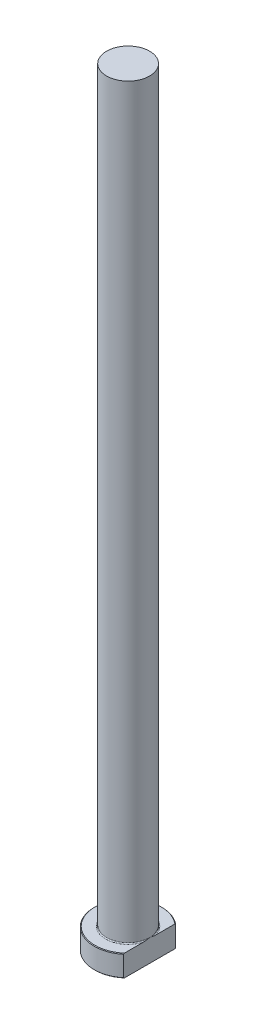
SolidWorks part; units mm, degrees
ref_plane "Front Plane" through (0, 0, 0) normal (0, 0, 1) x (1, 0, 0)
ref_plane "Top Plane" through (0, 0, 0) normal (0, 1, 0) x (1, 0, 0)
ref_plane "Right Plane" through (0, 0, 0) normal (1, 0, 0) x (0, 0, -1)
sketch "Sketch1" plane through (0, 0, 0) normal (0, 0, 1) x (1, 0, 0)
  line L0 (0, 259.9588) -> (0, -15.1925) construction
  line L1 (0, 0) -> (-11, 0)
  line L2 (-11, 0) -> (-11, 7)
  line L3 (-11, 7) -> (-7, 7)
  line L4 (-7, 7) -> (-7, 250)
  line L5 (-7, 250) -> (0, 250)
  line L6 (0, 250) -> (0, 0)
  dimension "L" = 250
  dimension "H" = 22
  dimension "T" = 7
  dimension "D" = 14
revolve "Revolve1" add sketch "Sketch1" angle 360 about L0
chamfer "Chamfer1" distance 0.2 angle 45 2 edges at (0, 7, 11) (0, 0, 11)
fillet "Fillet1" radius 0.3 1 edges at (0, 7, 7)
sketch "Sketch2" plane through (0, 0, 0) normal (0, 1, 0) x (1, 0, 0)
  line L0 (7, 8.4853) -> (7, -8.4853)
  circle A0 centre (0, 0) radius 11 construction
  arc A1 (7, -8.4853) -> (7, 8.4853) centre (0, 0) ccw
  circle A2 centre (0, 0) radius 7 construction
extrude "KEY" cut sketch "Sketch2" along normal through all
